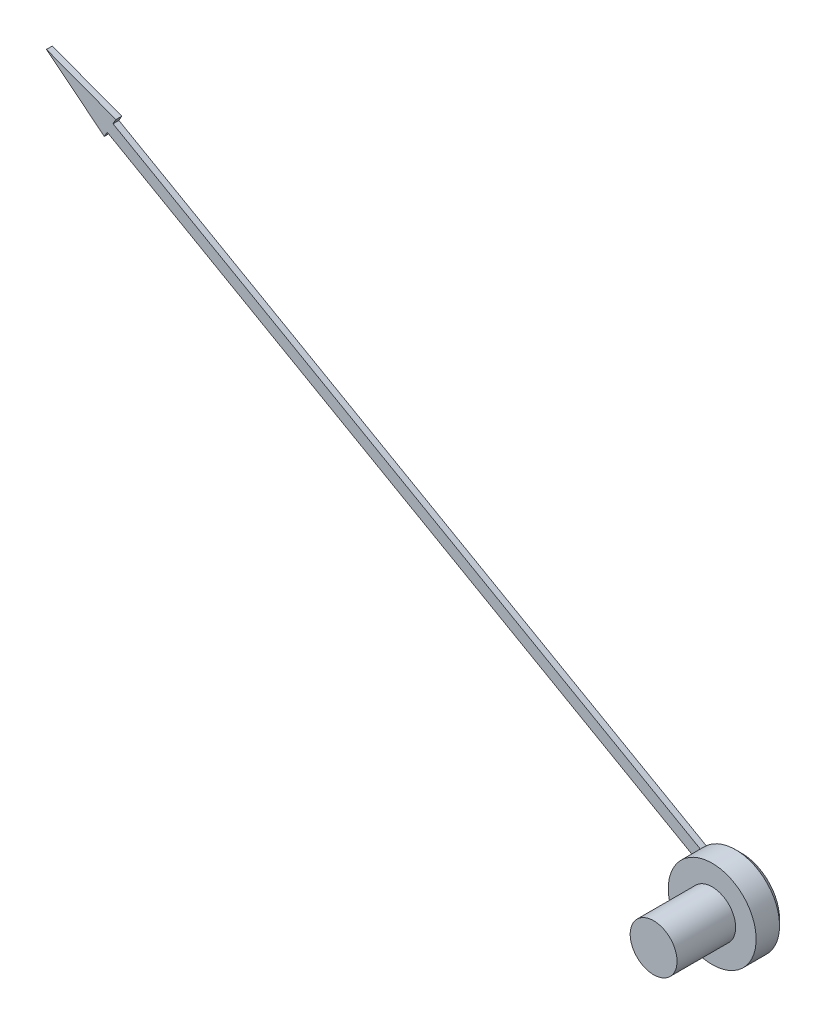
SolidWorks part; units mm, degrees
ref_plane "Plan1" through (0, 0, 0) normal (0, 0, 1) x (1, 0, 0)
ref_plane "Plan2" through (0, 0, 0) normal (0, 1, 0) x (1, 0, 0)
ref_plane "Plan3" through (0, 0, 0) normal (1, 0, 0) x (0, 0, -1)
sketch "Esquisse1" plane through (0, 0, 0) normal (0, 0, 1) x (1, 0, 0)
  circle A0 centre (0, 0) radius 8
  dimension "D1" = 16
extrude "Base-Extrusion" add sketch "Esquisse1" along normal blind 20
sketch "Esquisse2" plane through (0, 0, 0) normal (0, 0, -1) x (-1, 0, 0)
  circle A0 centre (0, 0) radius 15
  dimension "D1" = 30
extrude "Boss.-Extru.1" add sketch "Esquisse2" along normal blind 10
chamfer "Chanfrein1" distance 2 angle 45
sketch "Esquisse3" plane through (0, 0, 20) normal (0, 0, 1) x (1, 0, 0)
  point P0 (0, 0)
sketch "Esquisse4" plane through (0, 0, -10) normal (0, 0, -1) x (-1, 0, 0)
  point P0 (0, 0)
sketch "Esquisse5" plane through (0, 0, -10) normal (0, 0, -1) x (-1, 0, 0)
  line L0 (0, 0) -> (235.3016, 133.9748) construction
  line L2 (0.9896, -1.738) -> (-0.9896, 1.738)
  line L3 (-0.9896, 1.738) -> (212.5775, 123.3378)
  line L4 (212.5775, 123.3378) -> (211.5879, 125.0758)
  line L5 (211.5879, 125.0758) -> (235.3016, 133.9748)
  line L6 (215.5463, 118.1237) -> (235.3016, 133.9748)
  line L7 (214.5567, 119.8617) -> (215.5463, 118.1237)
  line L8 (0.9896, -1.738) -> (214.5567, 119.8617)
  dimension "D1" = 4
  dimension "D2" = 8
extrude "Boss.-Extru.2" add sketch "Esquisse5" against normal blind 2
